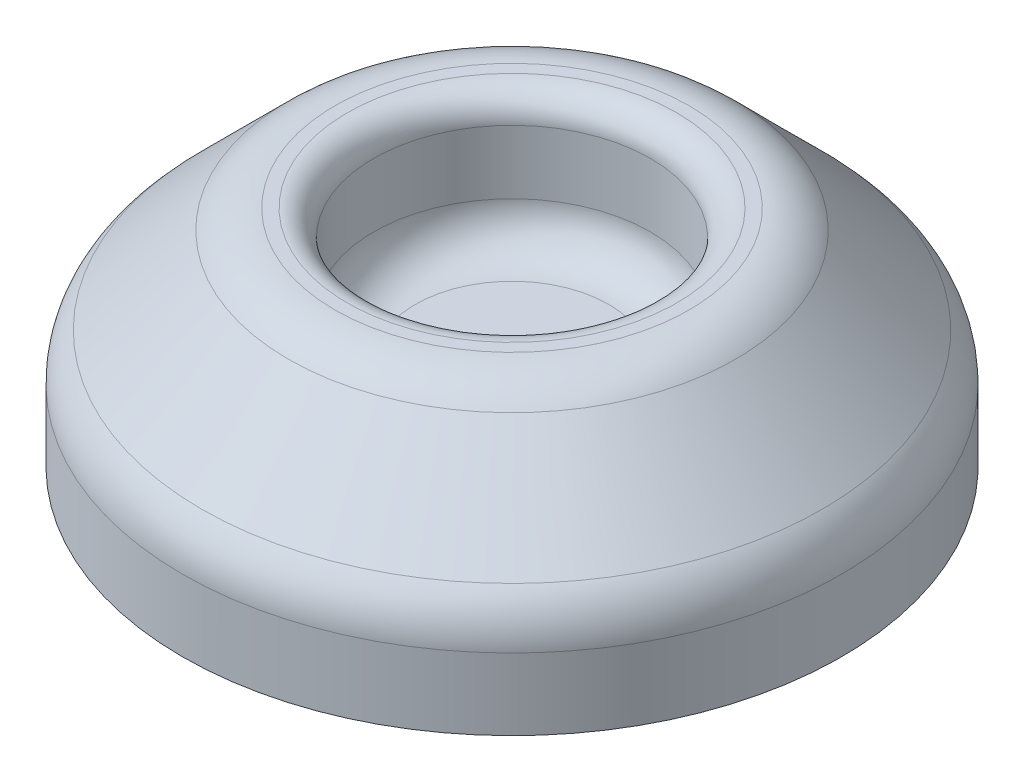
SolidWorks part; units mm, degrees
ref_plane "Front Plane" through (0, 0, 0) normal (0, 0, 1) x (1, 0, 0)
ref_plane "Top Plane" through (0, 0, 0) normal (0, 1, 0) x (1, 0, 0)
ref_plane "Right Plane" through (0, 0, 0) normal (1, 0, 0) x (0, 0, -1)
sketch "Sketch1" plane through (0, 0, 0) normal (0, 0, 1) x (1, 0, 0)
  line L0 (717.4648, 160.5968) -> (419.8482, 160.5968)
  line L1 (419.8482, 160.5968) -> (448.1927, 255.0783)
  line L2 (448.1927, 255.0783) -> (448.1927, 347.1977)
  line L3 (448.1927, 347.1977) -> (509.6056, 425.1449)
  line L4 (509.6056, 425.1449) -> (630.0695, 425.1449)
  line L5 (630.0695, 425.1449) -> (630.0695, 347.1977)
  line L6 (630.0695, 347.1977) -> (941.8582, 347.1977)
  line L7 (941.8582, 347.1977) -> (941.8582, 425.1449)
  line L8 (941.8582, 425.1449) -> (1067.0462, 425.1449)
  line L9 (1067.0462, 425.1449) -> (1128.4591, 347.1977)
  line L10 (1128.4591, 347.1977) -> (1128.4591, 255.0783)
  line L11 (1128.4591, 255.0783) -> (1161.5276, 160.5968)
  line L12 (1161.5276, 160.5968) -> (717.4648, 160.5968)
sketch "Sketch2" plane through (0, 0, 0) normal (0, 0, 1) x (1, 0, 0)
  line L0 (25, 0) -> (25, 7.5)
  line L1 (25, 7.5) -> (15.5, 17)
  line L2 (0, 7) -> (0, 0)
  line L32 (10.5, 7) -> (0, 7)
  line L33 (10.5, 17) -> (10.5, 7)
  line L34 (15.5, 17) -> (10.5, 17)
  line L38 (0, 0) -> (25, 0)
  dimension "D2" = 10.5
  dimension "D3" = 25
  dimension "D4" = 135
  dimension "D1" = 10
  dimension "D5" = 17
  dimension "D6" = 5
revolve "Revolve1" add sketch "Sketch2" angle 360 about L2
fillet "Fillet1" radius 5 2 edges at (0, 7.5, 25) (0, 17, 15.5)
fillet "Fillet2" radius 2 1 edges at (0, 17, 10.5)
fillet "Fillet3" radius 3.175 1 edges at (0, 7, 10.5)
shell "Shell1" thickness 1
